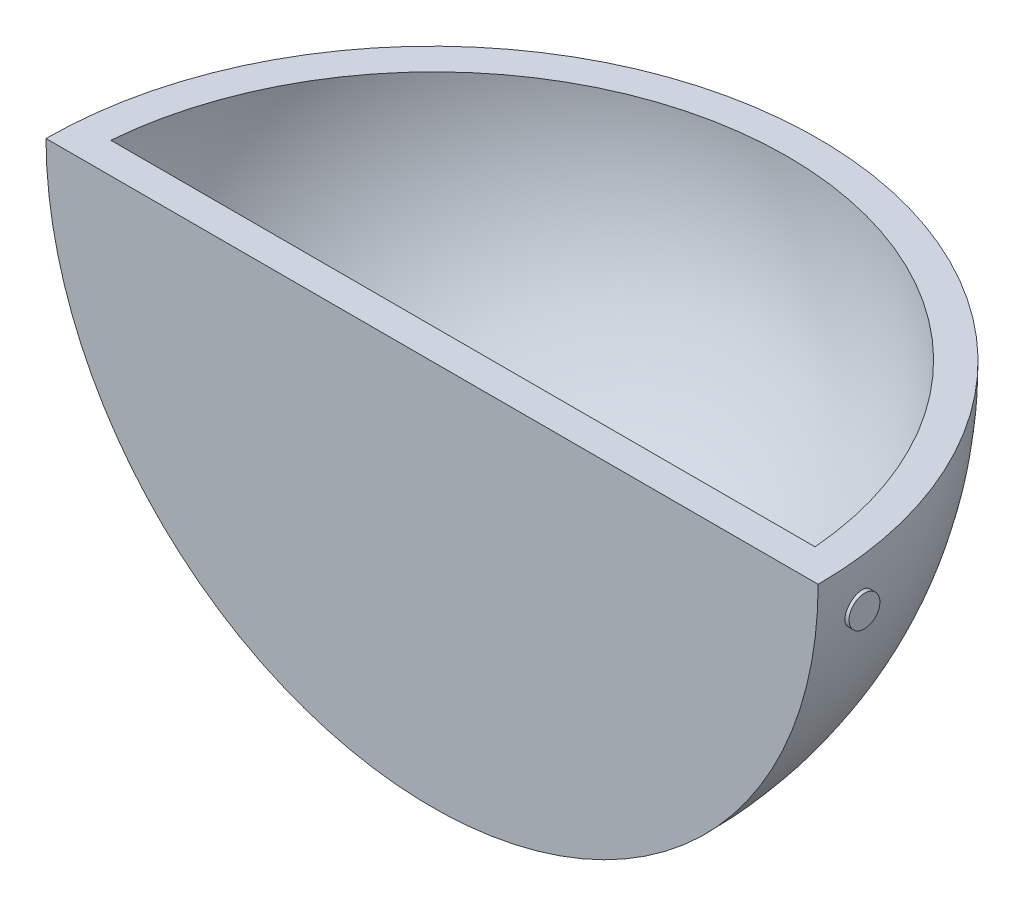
SolidWorks part; units mm, degrees
ref_plane "Alzado" through (0, 0, 0) normal (0, 0, 1) x (1, 0, 0)
ref_plane "Planta" through (0, 0, 0) normal (0, 1, 0) x (1, 0, 0)
ref_plane "Vista lateral" through (0, 0, 0) normal (1, 0, 0) x (0, 0, -1)
sketch "Croquis1" plane through (0, 0, 0) normal (0, 0, 1) x (1, 0, 0)
  line L0 (0, 0) -> (250, 0) construction
  line L1 (0, 0) -> (250, 0)
  arc A2 (0, 0) -> (250, 0) centre (125, 0) ccw
  point P0 (0, 0)
  point P5 (0, 0)
  dimension "D1" = 250
revolve "Revolución1" add sketch "Croquis1" angle 90 about L0
sketch "Croquis2" plane through (0, 0, 0) normal (1, 0, 0) x (0, 0, -1)
  line L0 (0, 0) -> (15, 0) construction
  line L1 (15, 0) -> (15, -15) construction
  line L2 (125, 0) -> (0, 0) construction
  circle A0 centre (15, -15) radius 5
  point P4 (0, 0)
  point P7 (0, 0)
extrude "Saliente-Extruir1" add sketch "Croquis2" along normal blind 250
sketch "Croquis4" plane through (0, 0, 0) normal (0, 1, 0) x (1, 0, 0)
  line L0 (0, 0) -> (125, 0) construction
  line L2 (0, 0) -> (250, 0) construction
  line L3 (11, 10) -> (239, 10)
  line L4 (125, 0) -> (125, 10) construction
  line L5 (125, 10) -> (125, 115) construction
  arc A0 (239, 10) -> (11, 10) centre (125, 0.6143) ccw
  point P9 (125, 0)
  point P11 (125, 10)
revolve "Cortar-Revolución1" cut sketch "Croquis4" angle 90 about L3
